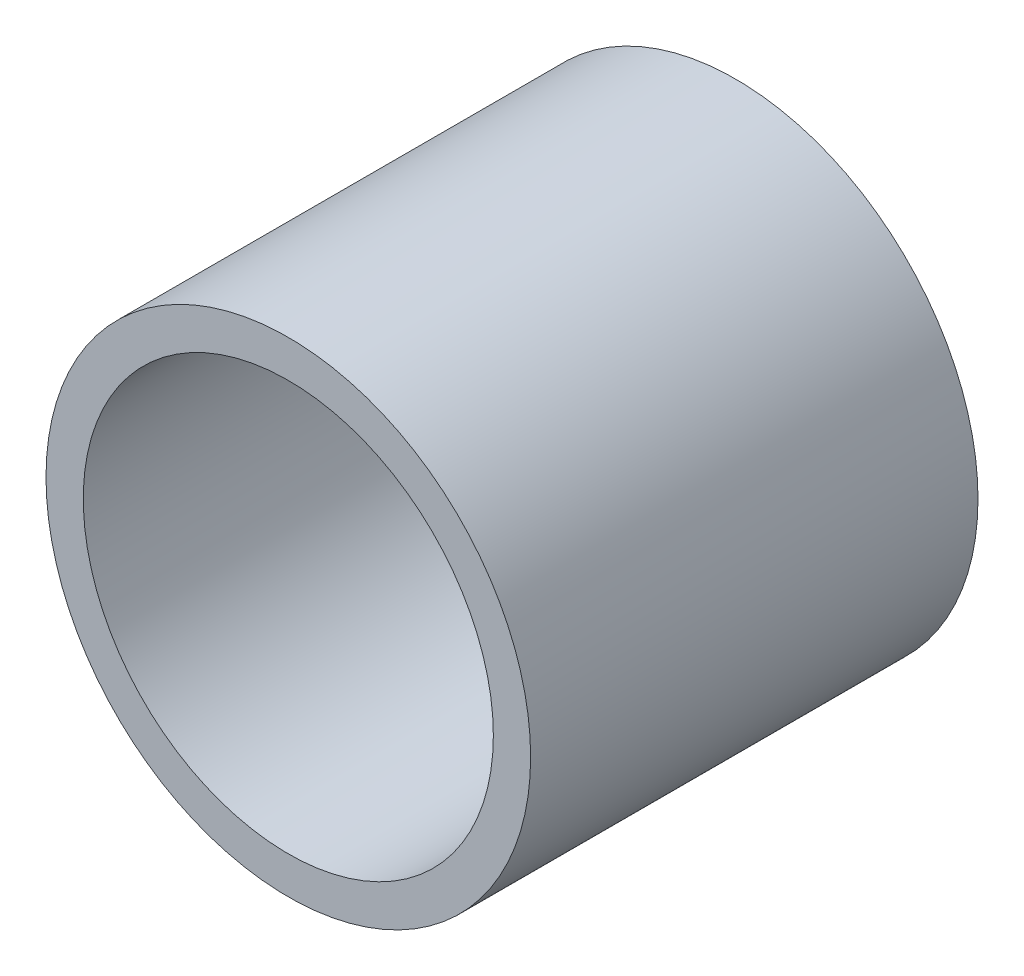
SolidWorks part; units mm, degrees
ref_plane "Plan de face" through (0, 0, 0) normal (0, 0, 1) x (1, 0, 0)
ref_plane "Plan de dessus" through (0, 0, 0) normal (0, 1, 0) x (1, 0, 0)
ref_plane "Plan de droite" through (0, 0, 0) normal (1, 0, 0) x (0, 0, -1)
sketch "Esquisse1" plane through (0, 0, 0) normal (0, 0, 1) x (1, 0, 0)
  circle A0 centre (0, 0) radius 13
  circle A1 centre (0, 0) radius 11
  dimension "D1" = 22
  dimension "D2" = 26
extrude "Extrusion1" add sketch "Esquisse1" along normal blind 24
chamfer "Chanfrein1" distance 1 angle 45 1 edges at (11, 0, 0)
